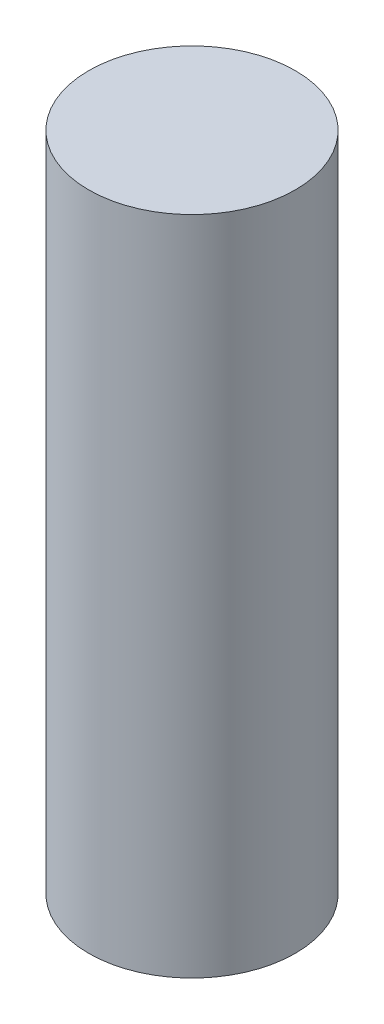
SolidWorks part; units mm, degrees
ref_plane "Front Plane" through (0, 0, 0) normal (0, 0, 1) x (1, 0, 0)
ref_plane "Top Plane" through (0, 0, 0) normal (0, 1, 0) x (1, 0, 0)
ref_plane "Right Plane" through (0, 0, 0) normal (1, 0, 0) x (0, 0, -1)
sketch "Sketch1" plane through (0, 0, 0) normal (0, 1, 0) x (1, 0, 0)
  circle A1 centre (0, 0) radius 7.9375
  dimension "D2" = 15.875
extrude "Extrude1" add sketch "Sketch1" along normal blind 50.8
